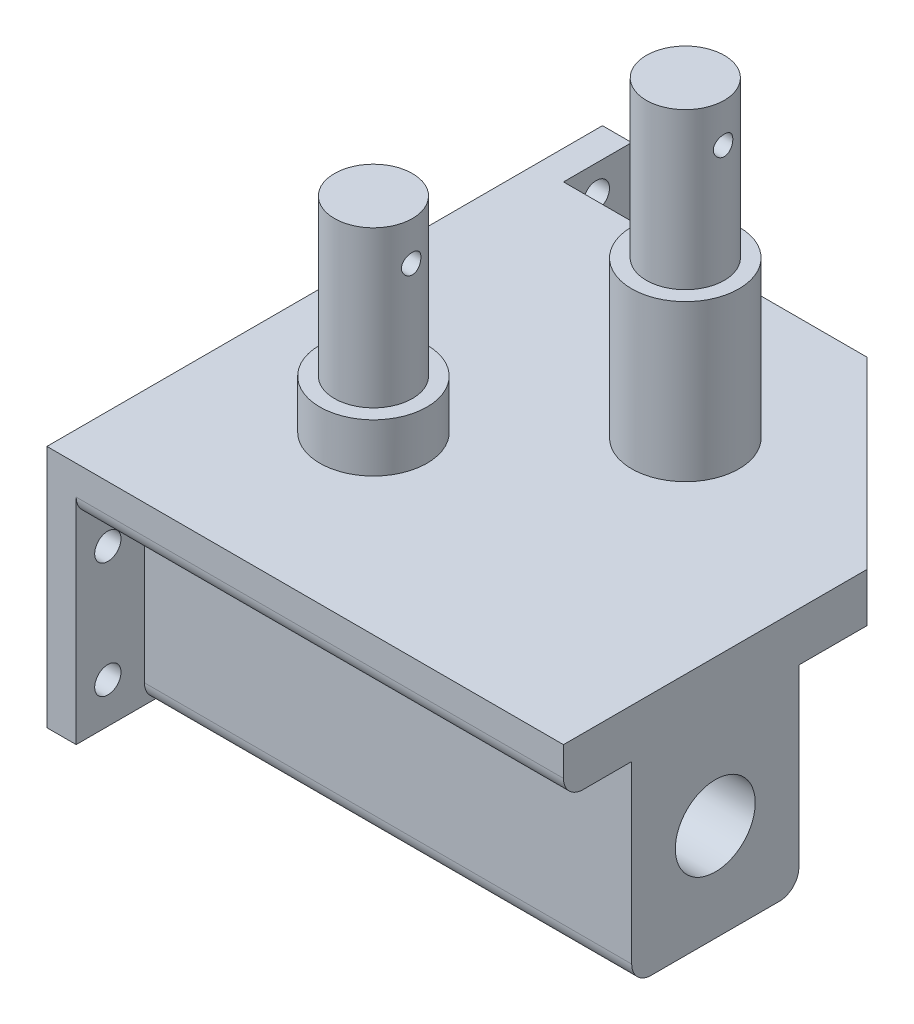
SolidWorks part; units mm, degrees
ref_plane "Front Plane" through (0, 0, 0) normal (0, 0, 1) x (1, 0, 0)
ref_plane "Top Plane" through (0, 0, 0) normal (0, 1, 0) x (1, 0, 0)
ref_plane "Right Plane" through (0, 0, 0) normal (1, 0, 0) x (0, 0, -1)
sketch "Sketch1" plane through (0, 0, 0) normal (0, 1, 0) x (1, 0, 0)
  line L0 (5.5296, -25.619) -> (24.381, -25.619)
  line L1 (-25.619, -25.619) -> (5.5296, -25.619)
  line L2 (-25.619, -25.619) -> (-25.619, 24.381)
  line L3 (-25.619, 24.381) -> (5.531, 24.381)
  line L4 (24.381, -6.7676) -> (24.381, 5.531)
  line L5 (-25.619, -25.619) -> (14.956, 14.956) construction
  line L6 (-25.619, 24.381) -> (15.9599, -15.1887) construction
  line L7 (24.381, -25.619) -> (24.381, -6.7676)
  line L8 (5.531, 24.381) -> (24.381, 5.531)
  circle A0 centre (3.381, 6.381) radius 8 construction
  circle A1 centre (-13.119, -9.119) radius 8 construction
  point P0 (0, 0)
extrude "Boss-Extrude1" add sketch "Sketch1" along normal blind 5
sketch "Sketch2" plane through (0, 0, 0) normal (0, -1, 0) x (1, 0, 0)
  line L0 (24.381, 10.044) -> (-25.619, 10.044) construction
  line L1 (24.381, 25.619) -> (24.381, -5.531) construction
  line L2 (-25.619, -24.381) -> (-25.619, 25.619) construction
  line L4 (-25.619, 18.619) -> (24.381, 18.619)
  line L5 (-25.619, 18.619) -> (-25.619, 1.469)
  line L6 (-25.619, 1.469) -> (24.381, 1.469)
  line L7 (24.381, 18.619) -> (24.381, 1.469)
  line L8 (-25.619, 18.619) -> (24.381, 1.469) construction
  line L9 (-25.619, 1.469) -> (24.381, 18.619) construction
  line L10 (-25.619, 25.619) -> (24.381, 25.619) construction
  point P6 (-0.619, 10.044)
  dimension "D1" = 7
extrude "Boss-Extrude2" add sketch "Sketch2" along normal blind 20
sketch "Sketch3" plane through (24.381, 0, 0) normal (1, 0, 0) x (0, 0, -1)
  line L0 (-10.044, -20) -> (-10.044, 5.2938) construction
  line L1 (-1.469, -20) -> (-18.619, -20) construction
  line L2 (-18.619, -10) -> (-1.469, -10) construction
  line L3 (-18.619, -20) -> (-18.619, 0) construction
  line L4 (-1.469, -20) -> (-1.469, 0) construction
  circle A0 centre (-10.044, -10) radius 4.1
  point P13 (-10.044, -10)
extrude "Cut-Extrude1" cut sketch "Sketch3" against normal blind 30
fillet "Fillet1" radius 2 4 edges at (-10.044, 0, -24.381) (-0.619, 0, 25.619) (-0.619, -20, 1.469) (-0.619, -20, 18.619)
sketch "Sketch5" plane through (0, 5, 0) normal (0, 1, 0) x (1, 0, 0)
  line L0 (-25.619, 24.381) -> (-25.619, -25.619) construction
  line L1 (5.531, 24.381) -> (-25.619, 24.381) construction
  line L3 (-25.619, -25.619) -> (24.381, -25.619) construction
  circle A0 centre (3.381, 7.881) radius 8 construction
  circle A1 centre (-13.119, -7.619) radius 8 construction
  circle A2 centre (3.381, 7.881) radius 5.5
  circle A3 centre (-13.119, -7.619) radius 5.5
extrude "Boss-Extrude3" add sketch "Sketch5" along normal blind 5
sketch "Sketch8" plane through (-25.619, 0, 0) normal (-1, 0, 0) x (0, 0, 1)
  line L0 (32.7919, 5) -> (-48.7637, 5) construction
  line L1 (-31.381, 5) -> (25.619, 5)
  line L2 (-31.381, 5) -> (-31.381, -20)
  line L3 (25.619, 5) -> (25.619, -20)
  line L4 (-31.381, -20) -> (25.619, -20)
  line L5 (16.619, -20) -> (3.469, -20) construction
  dimension "D1" = 7
extrude "Boss-Extrude5" add sketch "Sketch8" along normal blind 3
sketch "Sketch9" plane through (-25.619, 0, 0) normal (1, 0, 0) x (0, 0, -1)
  circle A0 centre (27.7527, 2.0917) radius 1.35
  circle A1 centre (27.7527, -15.858) radius 1.35
  circle A2 centre (-22.3682, -15.858) radius 1.35
  circle A3 centre (-22.3682, -3.996) radius 1.35
  point P8 (-22.3682, -15.858)
  point P9 (27.7527, -15.858)
extrude "Cut-Extrude2" cut sketch "Sketch9" against normal through all both and the other way through all
sketch "Sketch10" plane through (0, 10, 0) normal (0, 1, 0) x (1, 0, 0)
  circle A0 centre (-13.119, -7.619) radius 4
  dimension "D1" = 8
extrude "Boss-Extrude6" add sketch "Sketch10" along normal blind 16
sketch "Sketch11" plane through (0, 10, 0) normal (0, 1, 0) x (1, 0, 0)
  circle A0 centre (3.381, 7.881) radius 5.5 construction
  circle A1 centre (3.381, 7.881) radius 5.5
extrude "Boss-Extrude7" add sketch "Sketch11" along normal blind 11
sketch "Sketch12" plane through (0, 21, 0) normal (0, 1, 0) x (1, 0, 0)
  circle A0 centre (3.381, 7.881) radius 4
  dimension "D1" = 8
extrude "Boss-Extrude8" add sketch "Sketch12" along normal blind 16
sketch "Sketch13" plane through (-28.619, 0, 0) normal (-1, 0, 0) x (0, 0, 1)
  line L0 (-13.381, 21) -> (-2.381, 21) construction
  line L1 (2.119, 10) -> (13.119, 10) construction
  circle A0 centre (7.619, 22) radius 1
  circle A1 centre (-7.881, 33) radius 1
  point P12 (0, 0)
  point P13 (0, 0)
  point P14 (0, 0)
  point P15 (0, 0)
  point P16 (0, 0)
  point P17 (-7.881, 21)
  point P18 (0, 0)
  point P19 (7.619, 10)
  dimension "D1" = 2
  dimension "D2" = 2
  dimension "D3" = 12
  dimension "D4" = 12
extrude "Cut-Extrude3" cut sketch "Sketch13" against normal through all both and the other way through all
equation "\"screws\"= 2.7mm"
equation "\"D1@Sketch9\"=\"screws\""
equation "\"D2@Sketch9\"=\"screws\""
equation "\"D3@Sketch9\"=\"screws\""
equation "\"D4@Sketch9\"=\"screws\""
equation "\"barra\"= 8mm"
equation "\"D1@Sketch3\"=\"barra\"+0.2"
equation "\"a\"=12.5"
equation "\"b\"=18"
equation "\"c\"=29"
equation "\"d\"= 16.5"
equation "\"D6@Sketch1\"=\"c\""
equation "\"D5@Sketch1\"=\"b\""
equation "\"D8@Sketch1\"=\"d\""
equation "\"D7@Sketch1\"=\"a\""
equation "\"D7@Sketch5\"=\"c\""
equation "\"D8@Sketch5\"=\"d\""
equation "\"D9@Sketch5\"=\"a\""
equation "\"D10@Sketch5\"=\"b\""
